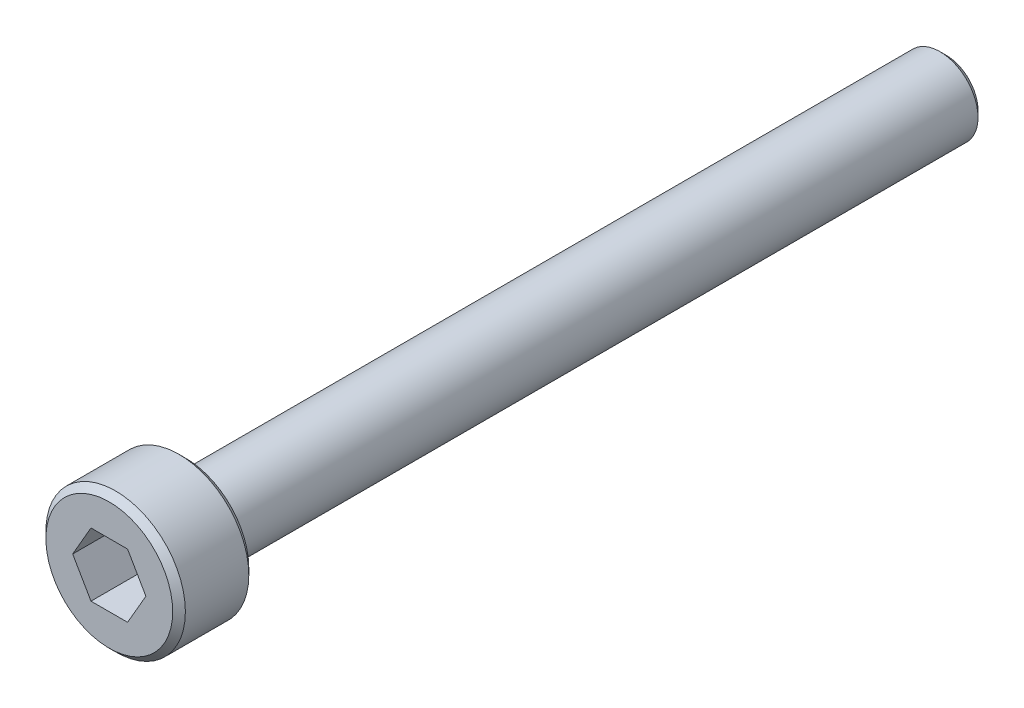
SolidWorks part; units mm, degrees
ref_plane "Front Plane" through (0, 0, 0) normal (1, 0, 0) x (0, 1, 0)
ref_plane "Top Plane" through (0, 0, 0) normal (0, 0, 1) x (0, 1, 0)
ref_plane "Right Plane" through (0, 0, 0) normal (0, 1, 0) x (-1, 0, 0)
sketch "Sketch1" plane through (0, 0, 0) normal (0, 0, 1) x (0, 1, 0)
  circle A0 centre (0, 0) radius 1.5
  dimension "D1" = 3
extrude "Boss-Extrude1" add sketch "Sketch1" along normal blind 30
sketch "Sketch2" plane through (0, 0, 30) normal (0, 0, 1) x (1, 0, 0)
  circle A0 centre (0, 0) radius 2.75
  dimension "D1" = 5.5
extrude "Boss-Extrude2" add sketch "Sketch2" along normal blind 3
chamfer "Chamfer1" distance 0.25 angle 45 3 edges at (2.75, 0, 30) (1.5, 0, 0) (2.75, 0, 33)
sketch "Sketch3" plane through (0, 0, 33) normal (0, 0, 1) x (1, 0, 0)
  line L1 (1.4434, 0) -> (0.7217, 1.25)
  line L2 (0.7217, 1.25) -> (-0.7217, 1.25)
  line L3 (-0.7217, 1.25) -> (-1.4434, 0)
  line L4 (-1.4434, 0) -> (-0.7217, -1.25)
  line L5 (-0.7217, -1.25) -> (0.7217, -1.25)
  line L6 (0.7217, -1.25) -> (1.4434, 0)
  circle A0 centre (0, 0) radius 1.25 construction
  point P1 (0, 0)
  dimension "D1" = 2.5
extrude "Cut-Extrude1" cut sketch "Sketch3" against normal blind 2
